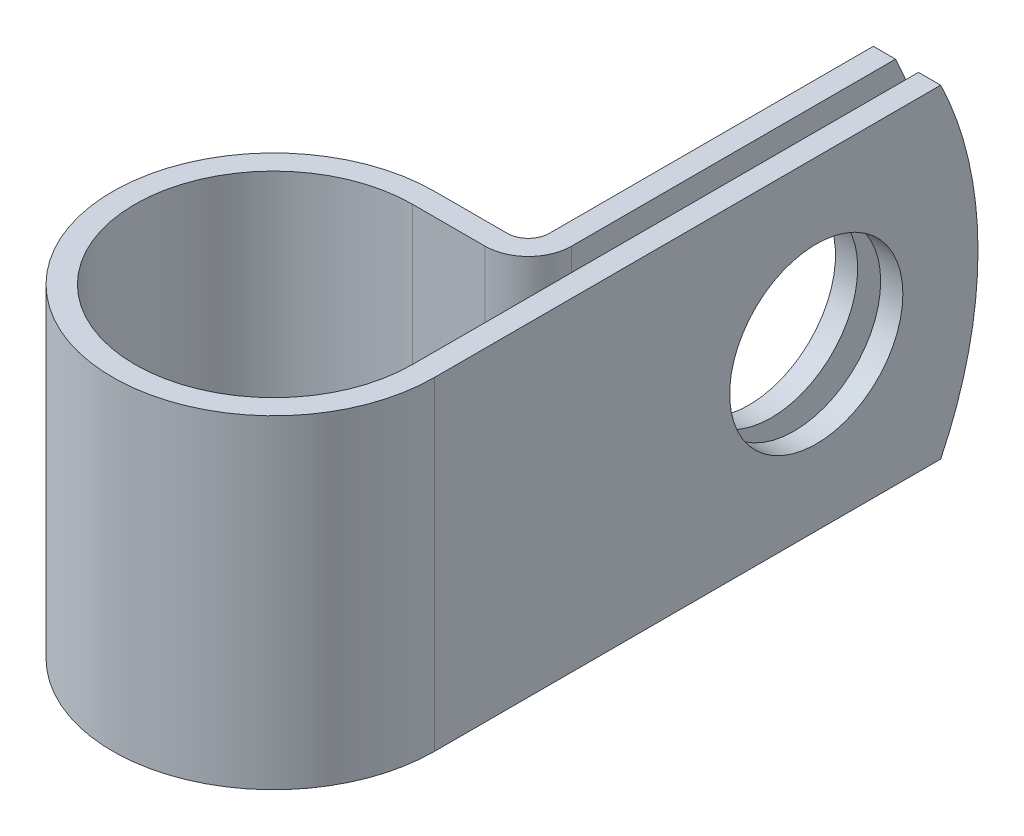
SolidWorks part; units mm, degrees
ref_plane "Front Plane" through (0, 0, 0) normal (0, 0, 1) x (1, 0, 0)
ref_plane "Top Plane" through (0, 0, 0) normal (0, 1, 0) x (1, 0, 0)
ref_plane "Right Plane" through (0, 0, 0) normal (1, 0, 0) x (0, 0, -1)
sketch "Sketch1" plane through (0, 0, 0) normal (0, 1, 0) x (1, 0, 0)
  line L0 (0, 9.525) -> (4.9784, 9.525)
  line L1 (9.525, 0) -> (9.525, 9.525)
  line L2 (7.9502, 37.2872) -> (7.9502, 12.4968)
  line L5 (9.525, 9.525) -> (9.525, 37.2872)
  arc A0 (0, 9.525) -> (9.525, 0) centre (0, 0) ccw
  arc A3 (4.9784, 9.525) -> (7.9502, 12.4968) centre (4.9784, 12.4968) ccw
extrude "Extrude-Thin1" add sketch "Sketch1" along normal mid plane 22.225 thin
sketch "Sketch2" plane through (6.4262, 0, 0) normal (-1, 0, 0) x (0, 0, 1)
  line L0 (-37.2872, 11.1125) -> (-37.2872, -11.1125) construction
  line L7 (0, 11.1125) -> (0, -11.1125) construction
  circle A0 centre (-26.1874, 0) radius 5.9436
  point P2 (-37.2872, 0)
extrude "Cut-Extrude1" cut sketch "Sketch2" against normal up to surface (1.524 mm away)
sketch "Sketch3" plane through (11.049, 0, 0) normal (1, 0, 0) x (0, 0, -1)
  line L0 (37.2872, 11.1125) -> (37.2872, -11.1125) construction
  circle A0 centre (26.1874, 0) radius 5.9436
  point P3 (37.2872, 0)
extrude "Cut-Extrude2" cut sketch "Sketch3" against normal up to surface (1.524 mm away)
sketch "Sketch4" plane through (6.4262, 0, 0) normal (-1, 0, 0) x (0, 0, 1)
  line L0 (-37.2872, 11.1125) -> (-37.2872, -11.1125)
  line L1 (-37.2872, 11.1125) -> (-34.7273, 11.1125)
  line L2 (-37.2872, 11.1125) -> (-12.4968, 11.1125) construction
  line L3 (-37.2872, -11.1125) -> (-34.7273, -11.1125)
  line L4 (-37.2872, -11.1125) -> (-12.4968, -11.1125) construction
  arc A0 (-34.7273, 11.1125) -> (-34.7273, -11.1125) centre (-11.8872, 0) ccw
extrude "Cut-Extrude3" cut sketch "Sketch4" against normal through all contours A0 M4 M5 | A0 L0 M2
equation "\"D1@Sketch3\"=\"D2@Sketch2\""
equation "\"D7@Sketch1\"=\"D3@Sketch2\" + \"D1@Sketch3\""
equation "\"D1@Sketch4\"=( \"D1@Extrude-Thin1\" + .125 ) * 2"
equation "\"D2@Sketch1\"=\"D5@Extrude-Thin1\" * 1.95"
equation "\"D2@Sketch3\"=\"D1@Sketch2\""
